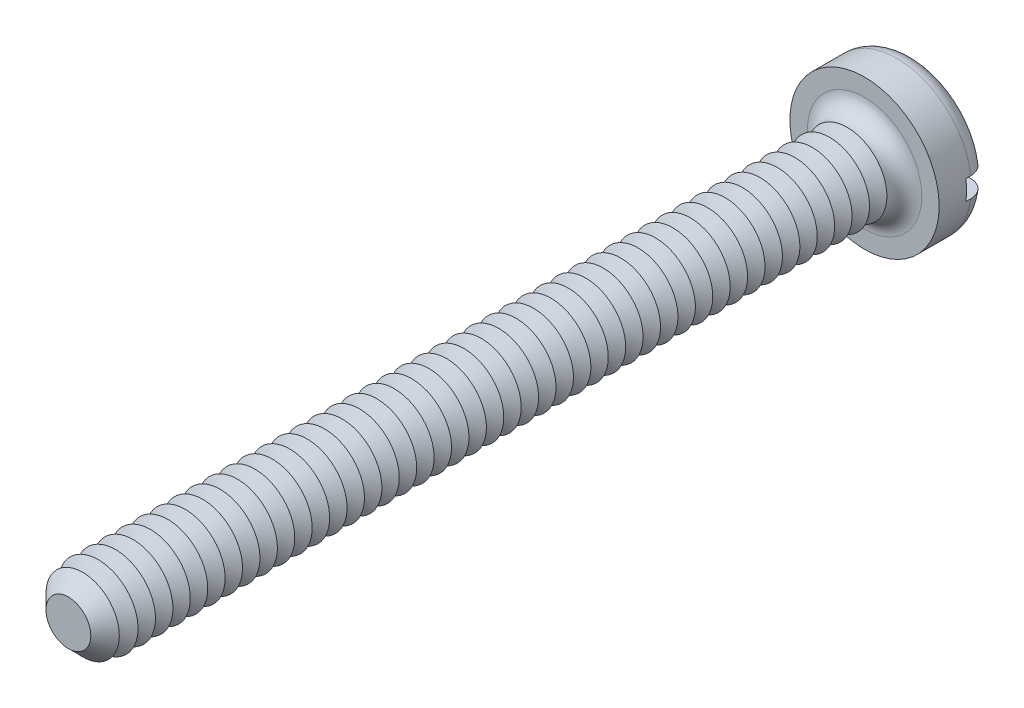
SolidWorks part; units mm, degrees
ref_plane "Front Plane" through (0, 0, 0) normal (0, 0, 1) x (1, 0, 0)
ref_plane "Top Plane" through (0, 0, 0) normal (0, 1, 0) x (1, 0, 0)
ref_plane "Right Plane" through (0, 0, 0) normal (1, 0, 0) x (0, 0, -1)
sketch "Sketch3" plane through (0, 0, 0) normal (0, 0, 1) x (1, 0, 0)
  circle A0 centre (0, 0) radius 1.5
  dimension "D1" = 3
extrude "Boss-Extrude2" add sketch "Sketch3" against normal blind 1
sketch "Sketch4" plane through (0, 0, 0) normal (0, 0, 1) x (1, 0, 0)
  circle A0 centre (0, 0) radius 0.8
  dimension "D1" = 1.6
extrude "Boss-Extrude3" add sketch "Sketch4" along normal blind 16
fillet "Fillet1" radius 0.35 2 edges at (1.5, 0, -1) (0.8, 0, 0)
chamfer "Chamfer1" distance 0.35 angle 45 1 edges at (0.8, 0, 16)
sketch "Sketch5" plane through (0, 0, 0) normal (1, 0, 0) x (0, 0, -1)
  line L0 (1.6944, 0) -> (-7.6738, 0) construction
sketch "Sketch6" plane through (0, 0, 0) normal (1, 0, 0) x (0, 0, -1)
  line L0 (-0.35, 0.8) -> (-0.525, 0.4969)
  line L1 (-0.525, 0.4969) -> (-0.7, 0.8)
  line L2 (-0.35, 0.8) -> (-15.65, 0.8) construction
  line L3 (-0.7, 0.8) -> (-0.35, 0.8)
  dimension "D1" = 0.35
revolve "Cut-Revolve1" cut sketch "Sketch6" angle 360 about L0
pattern_linear "LPattern1" count 44 spacing 0.35 along (0, 0, 1) of "Cut-Revolve1"
sketch "Sketch8" plane through (0, 0, -1) normal (0, 0, -1) x (-1, 0, 0)
  line L1 (1.5, -0.2) -> (-1.5, -0.2)
  line L2 (1.5, -0.2) -> (1.5, 0.2)
  line L3 (1.5, 0.2) -> (-1.5, 0.2)
  line L4 (-1.5, -0.2) -> (-1.5, 0.2)
  line L5 (1.5, -0.2) -> (-1.5, 0.2) construction
  line L6 (1.5, 0.2) -> (-1.5, -0.2) construction
  point P0 (0, 0)
  dimension "D1" = 3
  dimension "D2" = 0.4
extrude "Cut-Extrude1" cut sketch "Sketch8" against normal blind 0.45
